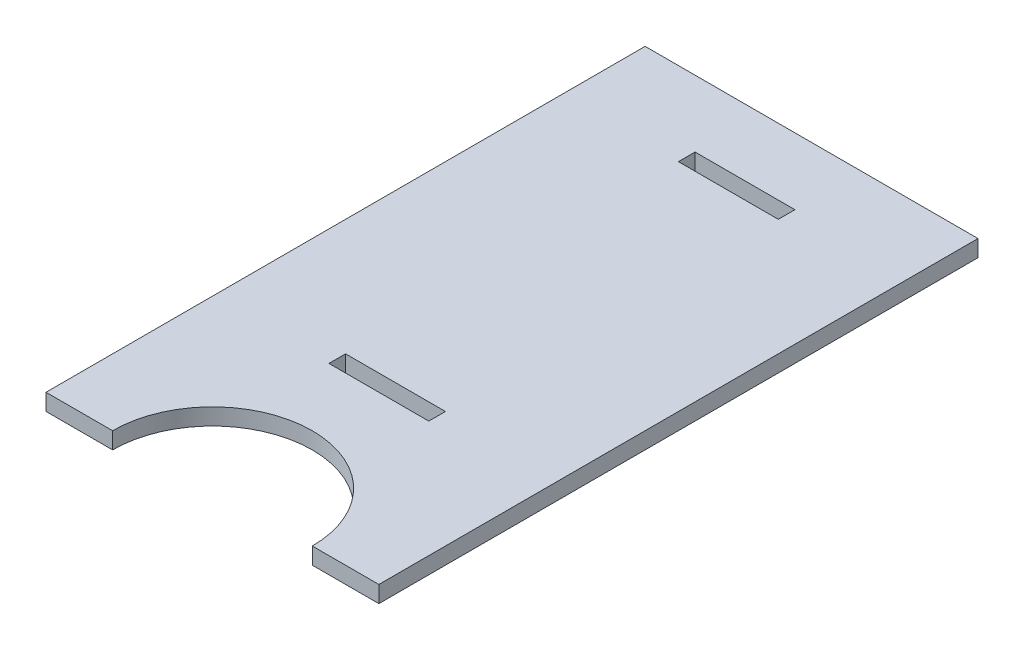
SolidWorks part; units mm, degrees
ref_plane "Alzado" through (0, 0, 0) normal (0, 0, 1) x (1, 0, 0)
ref_plane "Planta" through (0, 0, 0) normal (0, 1, 0) x (1, 0, 0)
ref_plane "Vista lateral" through (0, 0, 0) normal (1, 0, 0) x (0, 0, -1)
sketch "Croquis1" plane through (0, 0, 0) normal (0, 1, 0) x (1, 0, 0)
  line L1 (305.5164, -130.9064) -> (285.5164, -130.9064)
  line L2 (365.5164, -130.9064) -> (385.5164, -130.9064)
  line L8 (320.5164, -80.9064) -> (350.5164, -80.9064)
  line L10 (285.5164, -130.9064) -> (285.5164, 49.0936)
  line L11 (285.5164, 49.0936) -> (385.5164, 49.0936)
  line L12 (385.5164, -130.9064) -> (385.5164, 49.0936)
  line L13 (350.5164, -80.9064) -> (350.5164, -75.9064)
  line L14 (350.5164, -75.9064) -> (320.5164, -75.9064)
  line L15 (320.5164, -75.9064) -> (320.5164, -80.9064)
  line L17 (320.5164, 24.0936) -> (320.5164, 29.0936)
  line L18 (350.5164, 24.0936) -> (320.5164, 24.0936)
  line L19 (350.5164, 29.0936) -> (350.5164, 24.0936)
  line L20 (320.5164, 29.0936) -> (350.5164, 29.0936)
  arc A0 (365.5164, -130.9064) -> (305.5164, -130.9064) centre (335.5164, -130.9064) ccw
  point P0 (-30.909, -85.6617)
  point P1 (-30.909, 14.3383)
  point P2 (39.8017, 85.049)
  point P3 (210.5124, 14.3383)
  point P4 (139.8017, 85.049)
  point P6 (210.5124, -85.6617)
  point P7 (139.8017, -156.3724)
  point P8 (39.8017, -156.3724)
  point P14 (-35.909, -85.6617)
  point P17 (-35.909, 16.4093)
  point P22 (37.7306, 90.049)
  point P23 (141.8728, 90.049)
  point P24 (214.0479, 17.8738)
  point P25 (214.0479, -89.1973)
  point P26 (141.8728, -161.3724)
  point P27 (37.7306, -161.3724)
  point P28 (-34.4445, -89.1973)
  point P29 (215.5124, 14.3383)
  point P30 (215.5124, -85.6617)
  point P36 (-30.909, -20.6617)
  point P37 (210.5124, -20.6617)
  point P38 (210.5124, -50.6617)
  point P39 (-30.909, -50.6617)
  point P40 (164.5504, -131.6237)
  point P41 (-6.1602, 39.087)
  point P42 (15.053, 60.3002)
  point P43 (185.7636, -110.4105)
  dimension "D6" = 20
  dimension "D7" = 100
  dimension "D14" = 100
  dimension "D15" = 5
  dimension "D16" = 180
  dimension "D18" = 35
extrude "Saliente-Extruir1" add sketch "Croquis1" along normal blind 5
